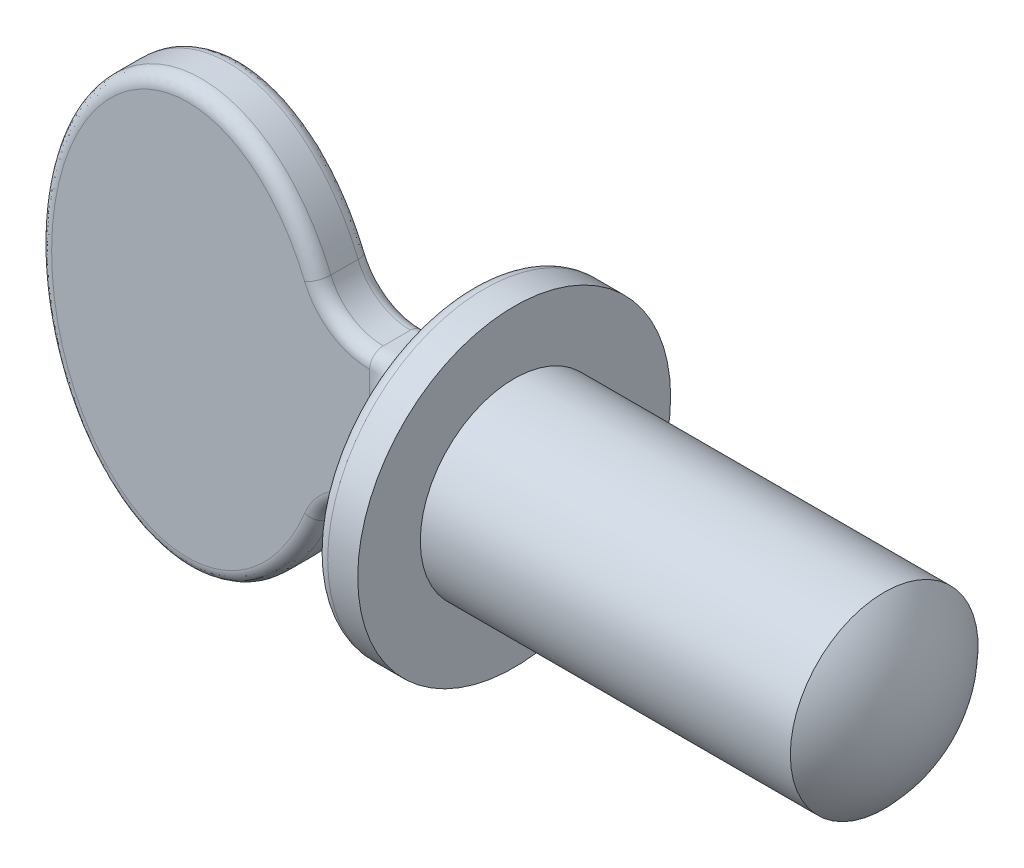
SolidWorks part; units mm, degrees
ref_plane "Front Plane" through (0, 0, 0) normal (0, 0, 1) x (1, 0, 0)
ref_plane "Top Plane" through (0, 0, 0) normal (0, 1, 0) x (1, 0, 0)
ref_plane "Right Plane" through (0, 0, 0) normal (1, 0, 0) x (0, 0, -1)
sketch "layout" plane through (0, 0, 0) normal (0, 0, 1) x (1, 0, 0)
  line L0 (0, 0) -> (13.208, 0) construction
  line L1 (5.588, 2.921) -> (5.588, -2.921)
  line L2 (3.3976, 1.3123) -> (4.8921, 1.3123) construction
  line L3 (5.588, 2.921) -> (4.7897, 2.921)
  line L4 (4.7897, 2.921) -> (4.7897, 3.2655) construction
  line L5 (4.2865, 1.706) -> (4.2865, 0)
  line L6 (4.2865, 1.706) -> (3.3355, 0.7551) construction
  line L7 (13.208, 1.7526) -> (13.208, 0)
  line L8 (3.3976, 1.3123) -> (3.3976, -1.3123)
  line L9 (13.208, 1.7526) -> (5.588, 1.7526)
  arc A0 (3.3976, 1.3123) -> (2.4197, 1.9685) centre (3.3976, 2.3692) cw
  arc A1 (4.7897, 2.921) -> (4.2865, 1.706) centre (3.0715, 2.921) cw
  arc A2 (3.3976, -1.3123) -> (2.4197, -1.9685) centre (3.3976, -2.3692) ccw
  ellipse E0 centre (0, 0) end of major axis (0, 3.937) minor radius 2.794 (2.4197, 1.9685) -> (2.4197, -1.9685) ccw
  dimension "Head Width" = 7.874
  dimension "Shoulder Dia" = 5.842
  dimension "Head Height" = 8.382
  dimension "D4" = 5.588
  dimension "D5" = 2.6247
  dimension "D6" = 3.937
  dimension "D7" = 3.4121
  dimension "D8" = 0.7983
  dimension "D9" = 45
  dimension "Length" = 7.62
  dimension "Base Screw Dia" = 3.5052
sketch "Sketch3" plane through (0, 0, 0) normal (0, 0, 1) x (1, 0, 0)
  line L0 (3.3976, 1.3123) -> (3.3976, -1.3123) construction
  line L1 (3.3976, 1.3123) -> (3.3976, -1.3123)
  arc A0 (3.3976, -1.3123) -> (2.4197, -1.9685) centre (3.3976, -2.3692) ccw construction
  arc A1 (2.4197, 1.9685) -> (3.3976, 1.3123) centre (3.3976, 2.3692) ccw construction
  arc A2 (3.3976, -1.3123) -> (2.4197, -1.9685) centre (3.3976, -2.3692) ccw
  arc A3 (2.4197, 1.9685) -> (3.3976, 1.3123) centre (3.3976, 2.3692) ccw
  ellipse E0 centre (0, 0) end of major axis (0, 3.937) minor radius 2.794 (2.4197, 1.9685) -> (2.4197, -1.9685) ccw construction
  ellipse E1 centre (0, 0) end of major axis (0, 3.937) minor radius 2.794 (2.4197, 1.9685) -> (2.4197, -1.9685) ccw
extrude "Extrude1" add sketch "Sketch3" along normal mid plane 1.016
fillet "Fillet1" radius 0.254 6 edges at (2.8088, 1.4916, -0.508) (2.8088, -1.4916, -0.508) (2.8088, 1.4916, 0.508) (2.8088, -1.4916, 0.508) (-2.794, 0, -0.508) (-2.794, 0, 0.508)
sketch "Sketch4" plane through (0, 0, 0) normal (0, 0, 1) x (1, 0, 0)
  line L1 (13.208, 1.7526) -> (5.588, 1.7526) construction
  line L2 (5.588, 2.921) -> (5.588, -2.921) construction
  line L3 (5.588, 2.921) -> (4.7897, 2.921) construction
  line L4 (4.2865, 1.706) -> (4.2865, 0) construction
  line L5 (13.208, 1.7526) -> (13.208, 0) construction
  line L6 (12.4966, 1.7526) -> (5.588, 1.7526)
  line L7 (5.588, 2.921) -> (5.588, 1.7526)
  line L8 (5.588, 2.921) -> (4.7897, 2.921)
  line L9 (4.2865, 1.706) -> (4.2865, 0)
  line L10 (0, 0) -> (16.8942, 0) construction
  line L11 (13.208, 0) -> (4.2865, 0)
  line L12 (13.208, 1.7526) -> (13.208, 0) construction
  arc A0 (4.2865, 1.706) -> (4.7897, 2.921) centre (3.0715, 2.921) ccw construction
  arc A1 (4.2865, 1.706) -> (4.7897, 2.921) centre (3.0715, 2.921) ccw
  arc A2 (13.208, 0) -> (12.4966, 1.7526) centre (10.6934, 0) ccw
  dimension "R" = 2.5146
  dimension "Ref" = 0.7114
revolve "Revolve1" add sketch "Sketch4" angle 360 about L10
loft "Loft1" add
fillet "Fillet2" radius 0.254 1 edges at (4.7897, 0, 2.921)
sketch "Sketch5" plane through (0, 0, 0) normal (0, 1, 0) x (1, 0, 0)
  line L0 (11.9511, 2.2981) -> (12.4966, 2.2981)
  line L1 (12.4966, 2.2981) -> (12.4966, 1.7526)
  line L2 (12.4966, 1.7526) -> (12.2239, 1.2802)
  line L3 (12.2239, 1.2802) -> (11.9511, 1.7526)
  line L5 (11.9511, 1.7526) -> (11.9511, 2.2981)
  line L7 (-3.6147, 0) -> (14.1406, 0) construction
  dimension "D1" = 0.4724
revolve "Cut-Revolve10" [suppressed] cut sketch "Sketch5" angle 360 about L7
pattern_linear "LPattern10" [suppressed] count 8 along (1, 0, 0)
equation "\"D4@layout\" = \"Head Height@layout\" / 3 * 2"
equation "\"D5@layout\" = \"Head Width@layout\" / 3"
equation "\"D6@layout\" = \"Head Width@layout\" / 2"
equation "\"D7@layout\" = \"D5@layout\" * 1.3"
equation "\"D8@layout\" = \"D4@layout\"  / 7"
equation "\"D1@Fillet1\" = \"Head Thickness@Extrude1\" / 4"
equation "\"D1@Fillet2\" = \"D1@Fillet1\""
equation "\"D1@Sketch5\" = ( \"Base Screw Dia@layout\"- \"Minor Dia@Cosmetic Thread1\" )  / 2"
equation "\"D1@LPattern10\" = int((\"Length@layout\"-\"Ref@Sketch4\")/\"Advance@LPattern10\")"
